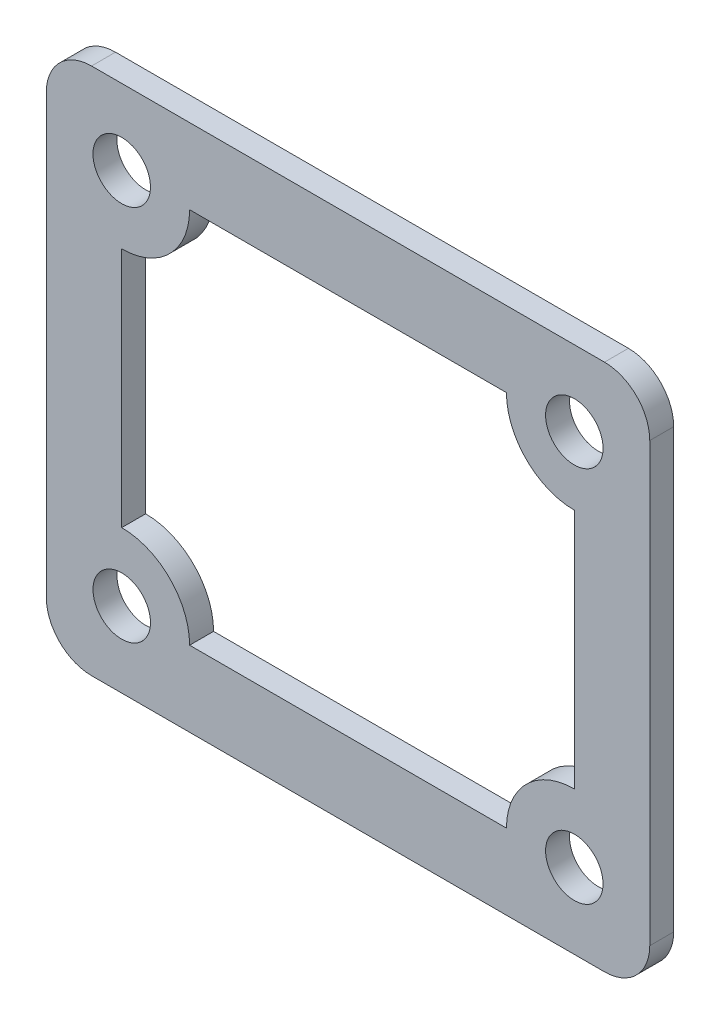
SolidWorks part; units mm, degrees
ref_plane "Front Plane" through (0, 0, 0) normal (0, 0, 1) x (1, 0, 0)
ref_plane "Top Plane" through (0, 0, 0) normal (0, 1, 0) x (1, 0, 0)
ref_plane "Right Plane" through (0, 0, 0) normal (1, 0, 0) x (0, 0, -1)
sketch "Sketch1" plane through (0, 0, 0) normal (0, 0, 1) x (1, 0, 0)
  line L1 (-20, 0) -> (20, 0) construction
  line L2 (-20, 17.5) -> (20, 17.5)
  line L3 (-20, 17.5) -> (-20, -17.5)
  line L4 (-20, -17.5) -> (20, -17.5)
  line L5 (20, 17.5) -> (20, -17.5)
  line L6 (-20, 17.5) -> (20, -17.5) construction
  line L7 (-20, -17.5) -> (20, 17.5) construction
  line L8 (0, 17.5) -> (0, -17.5) construction
  line L16 (-15, 8) -> (-15, -8)
  line L17 (10.5, -12.5) -> (-10.5, -12.5)
  line L20 (15, 8) -> (15, -8)
  line L26 (10.5, 12.5) -> (-10.5, 12.5)
  arc A5 (-10.5, -12.5) -> (-15, -8) centre (-15, -12.5) ccw
  arc A6 (10.5, -12.5) -> (15, -8) centre (15, -12.5) cw
  arc A9 (10.5, 12.5) -> (15, 8) centre (15, 12.5) ccw
  arc A10 (-10.5, 12.5) -> (-15, 8) centre (-15, 12.5) cw
  circle A12 centre (-15, -12.5) radius 1.905
  circle A13 centre (15, -12.5) radius 1.905
  circle A14 centre (15, 12.5) radius 1.905
  circle A15 centre (-15, 12.5) radius 1.905
  point P0 (0, 15.5)
  point P7 (-15, 0)
  point P24 (0, -12.5)
  point P26 (0, -15.5)
  point P39 (18, 0)
  point P40 (15, 0)
  point P42 (-18, 0)
  point P43 (0, 12.5)
  dimension "D11" = 4.5
  dimension "D1" = 40
  dimension "D2" = 35
  dimension "D3" = 5
  dimension "D4" = 5
  dimension "D6" = 5
extrude "Boss-Extrude1" add sketch "Sketch1" along normal blind 1.5875
fillet "Fillet1" radius 3 4 edges at (20, 17.5, 0.7937) (-20, 17.5, 0.7937) (-20, -17.5, 0.7937) (20, -17.5, 0.7937)
